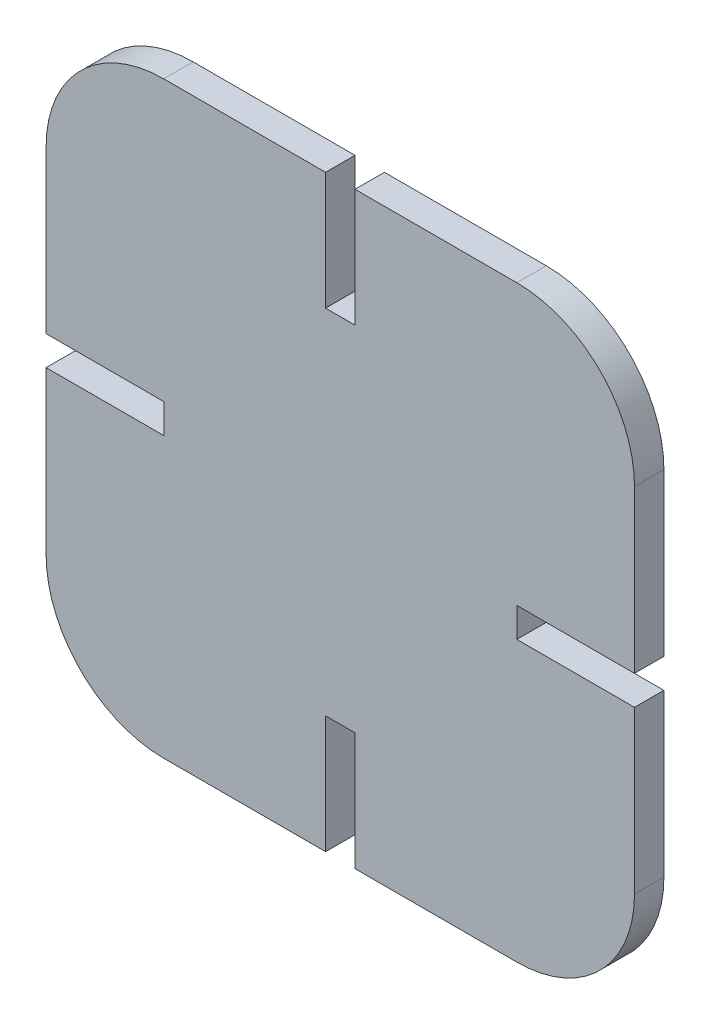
SolidWorks part; units mm, degrees
ref_plane "Front Plane" through (0, 0, 0) normal (0, 0, 1) x (1, 0, 0)
ref_plane "Top Plane" through (0, 0, 0) normal (0, 1, 0) x (1, 0, 0)
ref_plane "Right Plane" through (0, 0, 0) normal (1, 0, 0) x (0, 0, -1)
sketch "Sketch1" plane through (0, 0, 0) normal (0, 0, 1) x (1, 0, 0)
  line L0 (0, -955.6358) -> (0, 46826.156) construction
  line L1 (-955.6358, 0) -> (46826.156, 0) construction
  line L3 (-15, 25) -> (15, 25)
  line L4 (-25, 15) -> (-25, -15)
  line L5 (-15, -25) -> (15, -25)
  line L6 (25, 15) -> (25, -15)
  line L7 (-25, 25) -> (25, -25) construction
  line L8 (-25, -25) -> (25, 25) construction
  arc A0 (25, -15) -> (15, -25) centre (15, -15) cw
  arc A1 (-15, -25) -> (-25, -15) centre (-15, -15) cw
  arc A2 (25, 15) -> (15, 25) centre (15, 15) ccw
  arc A3 (-15, 25) -> (-25, 15) centre (-15, 15) ccw
  point P4 (0, 0)
extrude "Boss-Extrude1" add sketch "Sketch1" along normal blind 2.5 contours L3 A2 L6 A0 L5 A1 L4 A3
sketch "Sketch2" plane through (0, 0, 2.5) normal (0, 0, 1) x (1, 0, 0)
  line L0 (-1000, 0) -> (49000, 0) construction
  line L1 (0, -1000) -> (0, 49000) construction
  line L2 (-1.25, 15) -> (1.25, 15)
  line L3 (1.25, 15) -> (1.25, 25)
  line L4 (-15, 25) -> (15, 25) construction
  line L5 (-1.25, 15) -> (-1.25, 25)
  line L6 (-1.25, 25) -> (1.25, 25)
  line L7 (15, -1.25) -> (25, -1.25)
  line L8 (15, 1.25) -> (25, 1.25)
  line L9 (25, 1.25) -> (25, -1.25)
  line L10 (15, 1.25) -> (15, -1.25)
  line L11 (-1.25, -15) -> (-1.25, -25)
  line L12 (1.25, -15) -> (1.25, -25)
  line L13 (1.25, -25) -> (-1.25, -25)
  line L14 (1.25, -15) -> (-1.25, -15)
  line L15 (-15, 1.25) -> (-25, 1.25)
  line L16 (-15, -1.25) -> (-25, -1.25)
  line L17 (-25, -1.25) -> (-25, 1.25)
  line L18 (-15, -1.25) -> (-15, 1.25)
  line L19 (-25, 15) -> (-25, -15) construction
  line L20 (-15, -25) -> (15, -25) construction
  line L21 (25, 15) -> (25, -15) construction
  point P12 (0, 15)
  dimension "D1" = 1.25
  dimension "D2" = 10
  dimension "D4" = 4
extrude "Cut-Extrude3" cut sketch "Sketch2" against normal blind 2.5
equation "\"D2@Sketch1\"=\"D1@Sketch1\""
